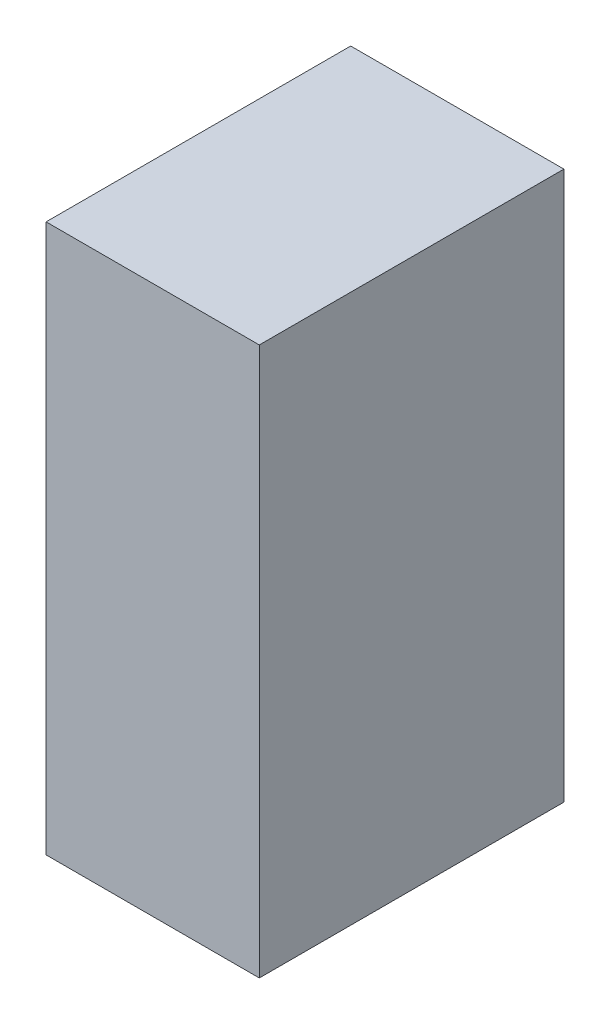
SolidWorks part; units mm, degrees
ref_plane "Front Plane" through (0, 0, 0) normal (0, 0, 1) x (1, 0, 0)
ref_plane "Top Plane" through (0, 0, 0) normal (0, 1, 0) x (1, 0, 0)
ref_plane "Right Plane" through (0, 0, 0) normal (1, 0, 0) x (0, 0, -1)
sketch "Sketch1" plane through (0, 0, 0) normal (0, 1, 0) x (1, 0, 0)
  line L0 (1599.9993, 923.76) -> (0, 1847.52)
  line L1 (0, 1847.52) -> (-1599.9993, 923.76)
  line L2 (-1599.9993, 923.76) -> (-1599.9993, -923.76)
  line L3 (-1599.9993, -923.76) -> (0, -1847.52)
  line L4 (0, -1847.52) -> (1599.9993, -923.76)
  line L5 (1599.9993, -923.76) -> (1599.9993, 923.76)
  line L6 (1519.9958, 877.57) -> (0, 1755.14)
  line L7 (0, 1755.14) -> (-1519.9958, 877.57)
  line L8 (-1519.9958, 877.57) -> (-1519.9958, -877.57)
  line L9 (-1519.9958, -877.57) -> (0, -1755.14)
  line L10 (0, -1755.14) -> (1519.9958, -877.57)
  line L11 (1519.9958, -877.57) -> (1519.9958, 877.57)
  line L13 (-650, -150) -> (650, -150)
  line L14 (-650, -150) -> (-650, 150)
  line L15 (-650, 150) -> (650, 150)
  line L16 (650, -150) -> (650, 150)
sketch "Sketch2" plane through (0, 0, 0) normal (0, 0, 1) x (1, 0, 0)
  line L1 (-700, 700) -> (700, 700)
  line L2 (-700, 700) -> (-700, 4300)
  line L3 (-700, 4300) -> (700, 4300)
  line L4 (700, 700) -> (700, 4300)
extrude "Boss-Extrude2" add sketch "Sketch2" along normal blind 2000
